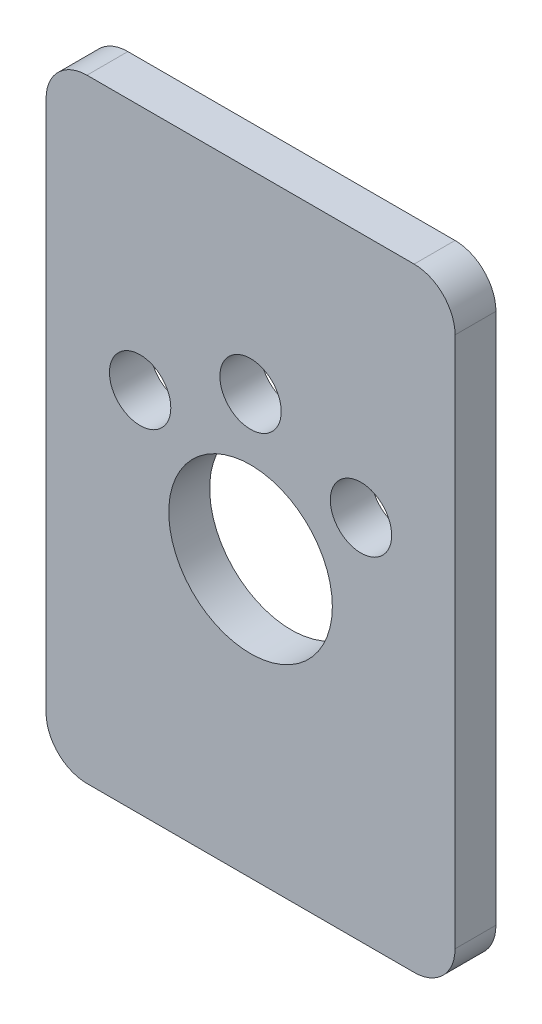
SolidWorks part; units mm, degrees
ref_plane "Plan de face" through (0, 0, 0) normal (0, 0, 1) x (1, 0, 0)
ref_plane "Plan de dessus" through (0, 0, 0) normal (0, 1, 0) x (1, 0, 0)
ref_plane "Plan de droite" through (0, 0, 0) normal (1, 0, 0) x (0, 0, -1)
sketch "Esquisse1" plane through (0, 0, 0) normal (0, 0, 1) x (1, 0, 0)
  line L0 (-50, 65) -> (-50, -65)
  line L1 (-40, -75) -> (40, -75)
  line L2 (50, -65) -> (50, 65)
  line L3 (40, 75) -> (-40, 75)
  line L4 (-40, 65) -> (40, -65) construction
  arc A0 (-40, 75) -> (-50, 65) centre (-40, 65) ccw
  arc A1 (50, 65) -> (40, 75) centre (40, 65) ccw
  arc A2 (40, -75) -> (50, -65) centre (40, -65) ccw
  arc A3 (-50, -65) -> (-40, -75) centre (-40, -65) ccw
  circle A4 centre (0, -7.5) radius 20
  circle A5 centre (-27, 14.8) radius 7.5
  circle A6 centre (0, 27.5) radius 7.5
  circle A7 centre (27, 14.8) radius 7.5
  point P6 (-50, 75)
  point P9 (50, 75)
  point P14 (-50, -75)
  dimension "D3" = 10
  dimension "D4" = 40
  dimension "D5" = 15
  dimension "D1" = 100
  dimension "D2" = 150
  dimension "D6" = 67.5
  dimension "D7" = 27
  dimension "D8" = 27
  dimension "D9" = 60.2
  dimension "D10" = 47.5
extrude "Extrusion1" add sketch "Esquisse1" along normal blind 10
